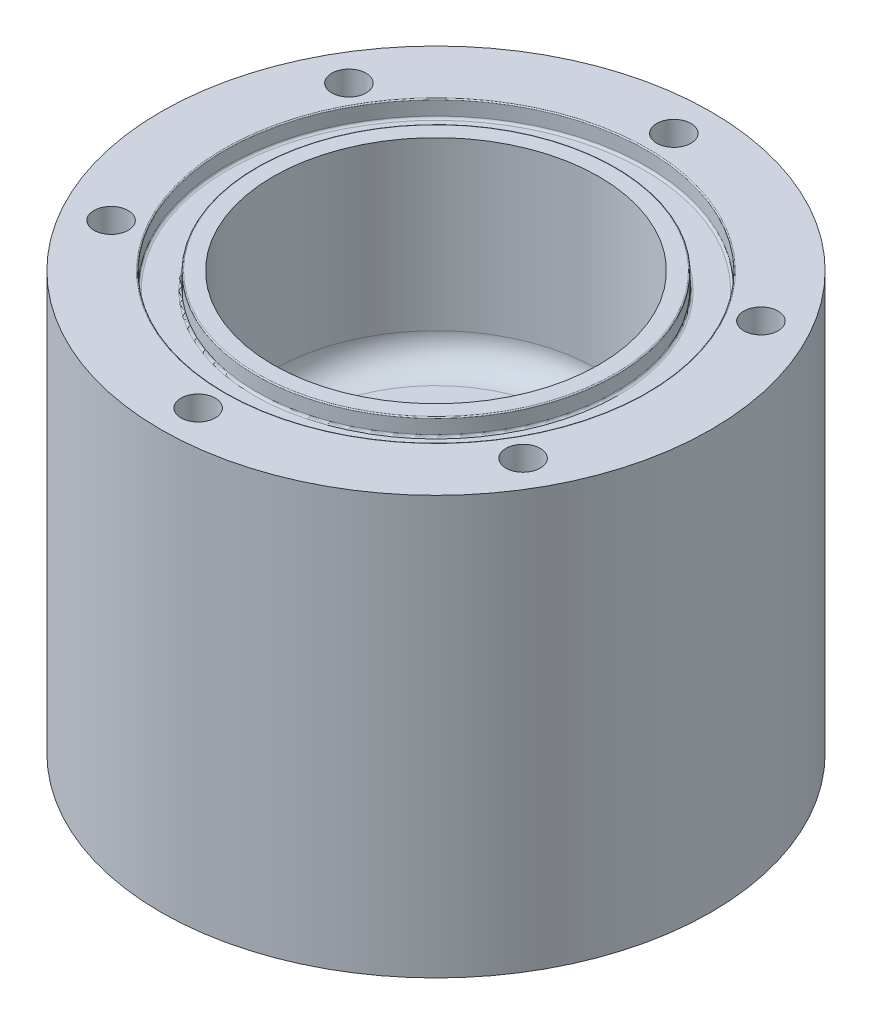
SolidWorks part; units mm, degrees
revolve "Base-Revolve" add sketch "Sketch1" angle 360 about L0
sketch "Sketch1" plane through (0, 0, 0) normal (0, 0, 1) x (1, 0, 0)
  line L0 (0, 71.4866) -> (0, -89.0309) construction
  line L2 (31.3531, 9.525) -> (31.3531, 57.15)
  line L3 (31.3531, 57.15) -> (24.13, 57.15)
  line L4 (18.5674, 57.15) -> (18.5674, 38.1)
  line L5 (15.3924, 34.925) -> (0, 34.925)
  line L6 (11.1125, 9.525) -> (11.1125, 28.575)
  line L7 (11.1125, 28.575) -> (0, 28.575)
  line L8 (20.4724, 57.023) -> (20.4724, 55.4482)
  line L9 (20.7264, 55.1942) -> (23.749, 55.1942)
  line L10 (24.003, 55.4482) -> (24.003, 57.023)
  line L11 (11.1125, 9.525) -> (31.3531, 9.525)
  line L12 (0, 34.925) -> (0, 28.575)
  line L13 (20.3454, 57.15) -> (18.5674, 57.15)
  arc A0 (20.7264, 55.1942) -> (20.4724, 55.4482) centre (20.7264, 55.4482) cw
  arc A1 (24.003, 55.4482) -> (23.749, 55.1942) centre (23.749, 55.4482) cw
  arc A2 (15.3924, 34.925) -> (18.5674, 38.1) centre (15.3924, 38.1) ccw
  arc A3 (20.3454, 57.15) -> (20.4724, 57.023) centre (20.3454, 57.023) cw
  arc A4 (24.13, 57.15) -> (24.003, 57.023) centre (24.13, 57.023) ccw
  point P21 (18.5674, 34.925)
  point P26 (20.4724, 57.15)
  dimension "D7" = 3.5306
  dimension "D8" = 3.175
  dimension "D10" = 0.254
  dimension "D11" = 0.127
  dimension "D1" = 11.1125
  dimension "D2" = 20.4724
  dimension "D3" = 6.35
  dimension "D4" = 1.905
  dimension "D5" = 22.225
  dimension "D6" = 19.05
  dimension "D9" = 1.9558
ref_plane "FRONT" through (0, 0, 0) normal (0, 0, 1) x (1, 0, 0)
ref_plane "TOP" through (0, 0, 0) normal (0, 1, 0) x (1, 0, 0)
ref_plane "RIGHT" through (0, 0, 0) normal (1, 0, 0) x (0, 0, -1)
sketch "Sketch2" plane through (0, 34.925, 0) normal (0, 1, 0) x (-1, 0, 0)
  circle A0 centre (0, 0) radius 0.9652
  circle A1 centre (0, 7.9375) radius 0.9652
  dimension "D1" = 7.9375
  dimension "wireHole" = 1.9304
extrude "Cut-Extrude1" cut sketch "Sketch2" against normal through all
pattern_circular "CirPattern1" count 6 every 60 about axis through (0, 71.4866, 0) along (0, -1, 0)
sketch "Sketch3" plane through (0, 57.15, 0) normal (0, 1, 0) x (-1, 0, 0)
  line L0 (0, 24.13) -> (0, 31.3531) construction
  circle A0 centre (0, 27.1018) radius 1.9558
  circle A1 centre (0, 0) radius 24.13 construction
  circle A2 centre (0, 0) radius 31.3531 construction
  dimension "D1" = 3.9116
  dimension "D2" = 1.016
extrude "Cut-Extrude2" cut sketch "Sketch3" against normal through all
pattern_circular "CirPattern2" count 6 every 60 about axis through (0, 71.4866, 0) along (0, -1, 0)
